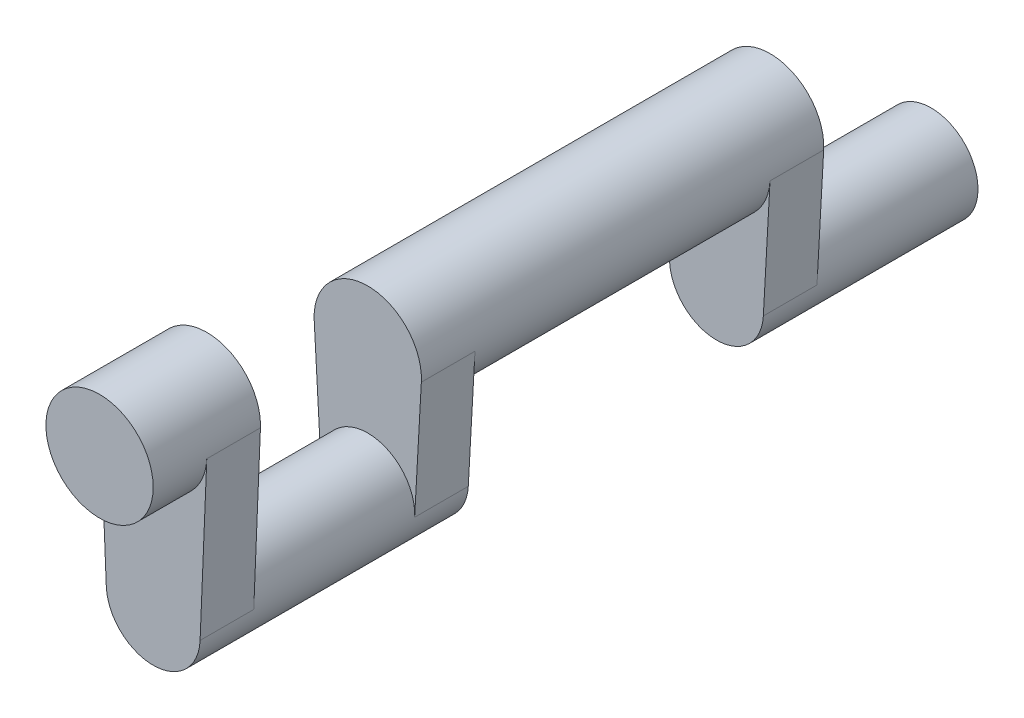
SolidWorks part; units mm, degrees
ref_plane "Front Plane" through (0, 0, 0) normal (0, 0, 1) x (1, 0, 0)
ref_plane "Top Plane" through (0, 0, 0) normal (0, 1, 0) x (1, 0, 0)
ref_plane "Right Plane" through (0, 0, 0) normal (1, 0, 0) x (0, 0, -1)
sketch "Sketch1" plane through (0, 0, 0) normal (0, 0, 1) x (1, 0, 0)
  circle A0 centre (0, 0) radius 25.4
  dimension "D1" = 50.8
extrude "Extrude1" add sketch "Sketch1" against normal blind 25.4
sketch "Sketch2" plane through (0, 0, -25.4) normal (0, 0, -1) x (-1, 0, 0)
  line L0 (-25.3779, -1.0583) -> (-22.2057, -77.126)
  line L1 (22.2057, -77.126) -> (25.3779, -1.0583)
  line L2 (0, 0) -> (0, -76.2) construction
  circle A0 centre (0, 0) radius 25.4 construction
  arc A1 (-22.2057, -77.126) -> (22.2057, -77.126) centre (0, -76.2) ccw
  arc A2 (25.3779, -1.0583) -> (-25.3779, -1.0583) centre (0, 0) ccw
  dimension "D1" = 76.2
extrude "large offset" add sketch "Sketch2" along normal blind 25.4
sketch "Sketch3" plane through (0, 0, -50.8) normal (0, 0, -1) x (-1, 0, 0)
  circle A0 centre (0, -76.2) radius 22.225
  dimension "D1" = 44.45
extrude "short cylinder1" add sketch "Sketch3" along normal blind 76.2
sketch "Sketch4" plane through (0, 0, -127) normal (0, 0, -1) x (-1, 0, 0)
  line L0 (-22.1907, -77.4347) -> (-25.3608, -20.4611)
  line L1 (25.3608, -20.4611) -> (22.1907, -77.4347)
  line L2 (0, -76.2) -> (0, -19.05) construction
  arc A0 (-25.3608, -20.4611) -> (25.3608, -20.4611) centre (0, -19.05) cw
  circle A1 centre (0, -76.2) radius 22.225
  arc A2 (-22.1907, -77.4347) -> (22.1907, -77.4347) centre (0, -76.2) ccw
  arc A5 (-66.6859, -124.8569) -> (66.6859, -27.5431) centre (0, -76.2) ccw
  circle A6 centre (0, -76.2) radius 82.55 construction
  dimension "D2" = 25.4
  dimension "D3" = 6.35
  dimension "D1" = 0
extrude "small offset1" add sketch "Sketch4" along normal blind 25.4
sketch "Sketch5" plane through (0, 0, -127) normal (0, 0, -1) x (-1, 0, 0)
  circle A0 centre (0, -19.05) radius 25.4
extrude "long cylinder" add sketch "Sketch5" along normal blind 190.5
sketch "Sketch6" plane through (0, 0, -317.5) normal (0, 0, -1) x (-1, 0, 0)
  line L0 (25.3608, -20.4611) -> (22.1907, -77.4347)
  line L1 (-22.1907, -77.4347) -> (-25.3608, -20.4611)
  line L2 (0, -76.2) -> (0, -19.05) construction
  arc A0 (22.1907, -77.4347) -> (-22.1907, -77.4347) centre (0, -76.2) cw
  circle A1 centre (0, -19.05) radius 25.4
  arc A2 (25.3608, -20.4611) -> (-25.3608, -20.4611) centre (0, -19.05) ccw
  arc A6 (-22.1907, -77.4347) -> (22.1907, -77.4347) centre (0, -76.2) ccw construction
  dimension "D1" = 0
extrude "small offset2" add sketch "Sketch6" against normal blind 25.4
sketch "Sketch7" plane through (0, 0, -317.5) normal (0, 0, 1) x (1, 0, 0)
  circle A0 centre (0, -76.2) radius 22.225
extrude "short cylinder2" add sketch "Sketch7" against normal blind 76.2
